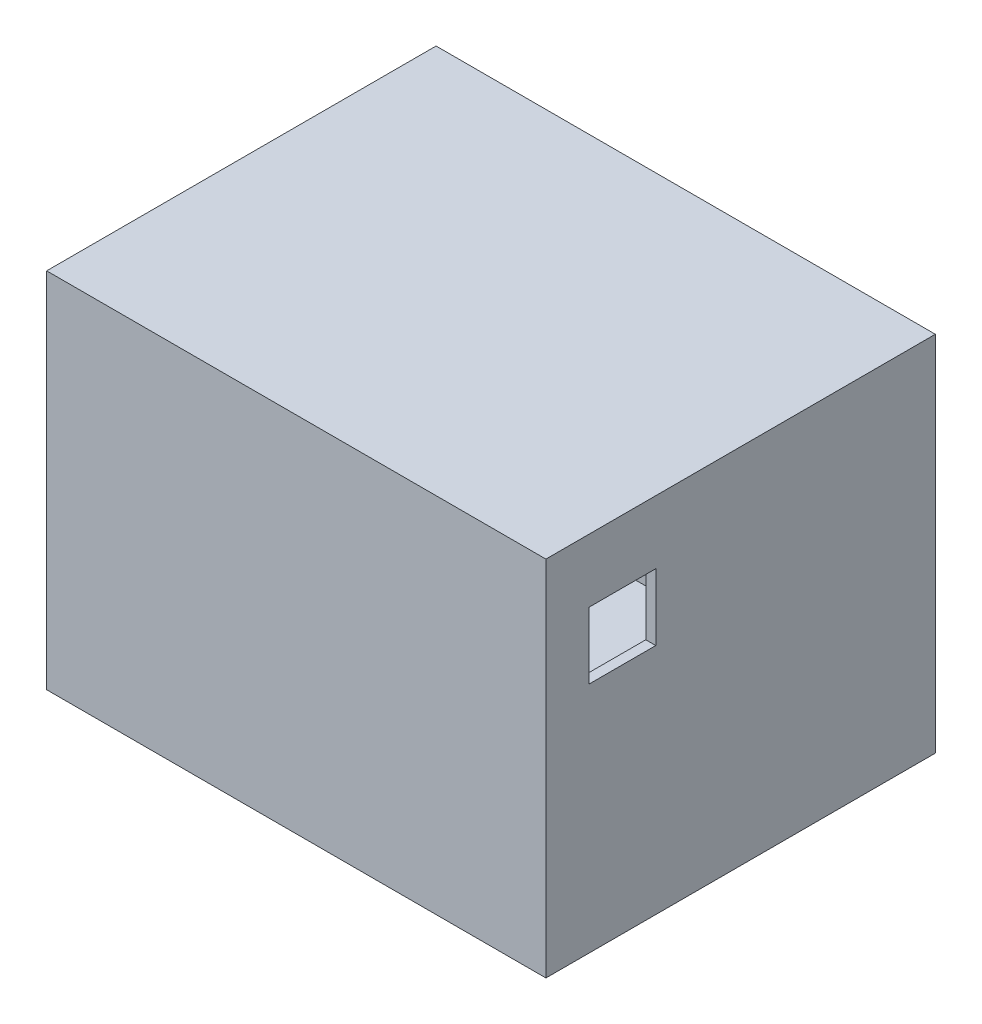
SolidWorks part; units mm, degrees
ref_plane "Front Plane" through (0, 0, 0) normal (0, 0, 1) x (1, 0, 0)
ref_plane "Top Plane" through (0, 0, 0) normal (0, 1, 0) x (1, 0, 0)
ref_plane "Right Plane" through (0, 0, 0) normal (1, 0, 0) x (0, 0, -1)
sketch "Sketch1" plane through (0, 0, 0) normal (0, 1, 0) x (1, 0, 0)
  line L1 (-91.9581, 58.3185) -> (3565.6419, 58.3185)
  line L2 (-91.9581, 58.3185) -> (-91.9581, -2761.0815)
  line L3 (-91.9581, -2761.0815) -> (3565.6419, -2761.0815)
  line L4 (3565.6419, 58.3185) -> (3565.6419, -2761.0815)
  dimension "D1" = 3657.6
  dimension "D2" = 2819.4
extrude "Boss-Extrude1" add sketch "Sketch1" along normal blind 76.2
sketch "Sketch2" plane through (0, 0, 0) normal (0, 1, 0) x (1, 0, 0)
  line L0 (-91.9581, 58.3185) -> (3565.6419, 58.3185) construction
  line L1 (3565.6419, 58.3185) -> (3565.6419, -2761.0815) construction
  line L2 (-91.9581, -2761.0815) -> (3565.6419, -2761.0815) construction
  line L3 (-91.9581, 58.3185) -> (-91.9581, -2761.0815) construction
  line L4 (-91.9581, 58.3185) -> (3565.6419, 58.3185)
  line L5 (3565.6419, 58.3185) -> (3565.6419, -2761.0815)
  line L6 (-91.9581, -2761.0815) -> (3565.6419, -2761.0815)
  line L7 (-91.9581, 58.3185) -> (-91.9581, -2761.0815)
  line L8 (-168.1581, 134.5185) -> (3641.8419, 134.5185)
  line L9 (3641.8419, 134.5185) -> (3641.8419, -2837.2815)
  line L10 (-168.1581, -2837.2815) -> (3641.8419, -2837.2815)
  line L11 (-168.1581, 134.5185) -> (-168.1581, -2837.2815)
  dimension "D1" = 76.2
extrude "Boss-Extrude2" add sketch "Sketch2" along normal blind 2692.4 separate body
sketch "Sketch4" plane through (3641.8419, 0, 0) normal (1, 0, 0) x (0, 0, -1)
  line L0 (-2837.2815, 0) -> (134.5185, 0) construction
  line L1 (-1999.0815, 1778) -> (-2507.0815, 1778)
  line L2 (-1999.0815, 1778) -> (-1999.0815, 2286)
  line L3 (-1999.0815, 2286) -> (-2507.0815, 2286)
  line L4 (-2507.0815, 1778) -> (-2507.0815, 2286)
  dimension "D1" = 254
  dimension "D2" = 508
  dimension "D3" = 508
  dimension "D4" = 1778
extrude "Cut-Extrude2" cut sketch "Sketch4" against normal up to next (76.2 mm away)
sketch "Sketch5" plane through (-91.9581, 0, 0) normal (1, 0, 0) x (0, 0, -1)
  line L0 (58.3185, 0) -> (-2761.0815, 0) construction
  line L1 (-1351.3815, 2197.1) -> (-1351.3815, 0) construction
  line L2 (-2837.2815, 0) -> (134.5185, 0) construction
  line L11 (-1846.6815, 2324.1) -> (-856.0815, 2324.1)
  line L12 (-1846.6815, 2324.1) -> (-1846.6815, 584.2)
  line L13 (-1846.6815, 584.2) -> (-856.0815, 584.2)
  line L14 (-856.0815, 2324.1) -> (-856.0815, 584.2)
  line L15 (-1732.3815, 2197.1) -> (-970.3815, 2197.1)
  line L16 (-1732.3815, 2197.1) -> (-1732.3815, 673.1)
  line L17 (-1732.3815, 673.1) -> (-970.3815, 673.1)
  line L18 (-970.3815, 2197.1) -> (-970.3815, 673.1)
  point P22 (-1351.3815, 2197.1)
  point P23 (-1732.3815, 1435.1)
  point P24 (-1351.3815, 2324.1)
  dimension "D1" = 762
  dimension "D2" = 990.6
  dimension "D4" = 584.2
  dimension "D5" = 1435.1
  dimension "D8" = 88.9
  dimension "D9" = 2324.1
extrude "Boss-Extrude3" add sketch "Sketch5" along normal blind 25.4 separate body
sketch "Sketch6" plane through (-91.9581, 0, 0) normal (1, 0, 0) x (0, 0, -1)
  line L4 (-970.3815, 2197.1) -> (-1732.3815, 2197.1) construction
  line L5 (-970.3815, 673.1) -> (-970.3815, 2197.1) construction
  line L6 (-1732.3815, 673.1) -> (-970.3815, 673.1) construction
  line L7 (-1732.3815, 2197.1) -> (-1732.3815, 673.1) construction
  line L12 (-970.3815, 2197.1) -> (-1732.3815, 2197.1)
  line L13 (-970.3815, 673.1) -> (-970.3815, 2197.1)
  line L14 (-1732.3815, 673.1) -> (-970.3815, 673.1)
  line L15 (-1732.3815, 2197.1) -> (-1732.3815, 673.1)
extrude "Cut-Extrude3" cut sketch "Sketch6" against normal through all
sketch "Sketch7" plane through (0, 0, -58.3185) normal (0, 0, 1) x (1, 0, 0)
  line L0 (3565.6419, 2692.4) -> (3565.6419, 0) construction
  line L1 (1679.6919, 2108.2) -> (2441.6919, 2108.2)
  line L2 (1679.6919, 2108.2) -> (1679.6919, 76.2)
  line L3 (1679.6919, 76.2) -> (2441.6919, 76.2)
  line L4 (2441.6919, 2108.2) -> (2441.6919, 76.2)
  line L5 (3565.6419, 76.2) -> (-91.9581, 76.2) construction
  dimension "D1" = 1123.95
  dimension "D2" = 762
  dimension "D3" = 2032
extrude "Cut-Extrude4" cut sketch "Sketch7" against normal blind 100
sketch "Sketch8" plane through (0, 2692.4, 0) normal (0, 1, 0) x (1, 0, 0)
  line L1 (-168.1581, 134.5185) -> (3641.8419, 134.5185)
  line L2 (-168.1581, 134.5185) -> (-168.1581, -2837.2815)
  line L3 (-168.1581, -2837.2815) -> (3641.8419, -2837.2815)
  line L4 (3641.8419, 134.5185) -> (3641.8419, -2837.2815)
extrude "Boss-Extrude4" add sketch "Sketch8" along normal blind 76.2
